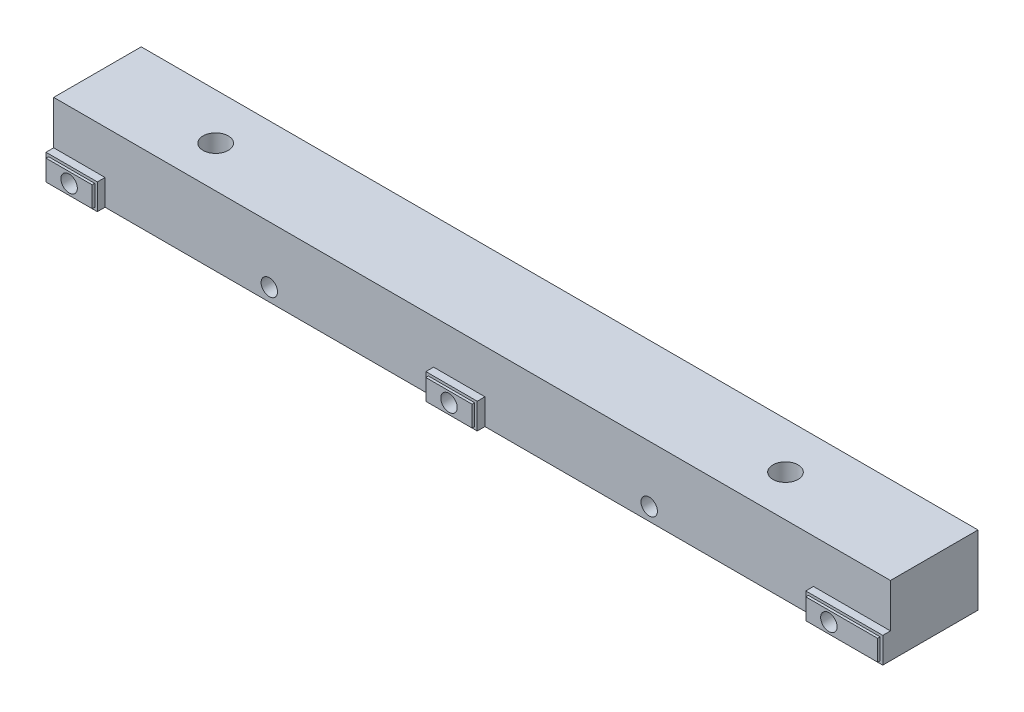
SolidWorks part; units mm, degrees
ref_plane "Front" through (0, 0, 0) normal (0, 0, 1) x (1, 0, 0)
ref_plane "Top" through (0, 0, 0) normal (0, 1, 0) x (1, 0, 0)
ref_plane "Right" through (0, 0, 0) normal (1, 0, 0) x (0, 0, -1)
sketch "Sketch1" plane through (0, 0, 0) normal (0, 1, 0) x (1, 0, 0)
  line L0 (0, 0) -> (0, 8.525) construction
  line L1 (-208, 8.525) -> (208, 8.525)
  line L2 (-208, 8.525) -> (-208, -8.525)
  line L3 (-208, -8.525) -> (208, -8.525)
  line L4 (208, 8.525) -> (208, -8.525)
  line L5 (0, 0) -> (208, 0) construction
  dimension "D1" = 416
  dimension "D2" = 17.05
extrude "Extrude1" add sketch "Sketch1" along normal blind 13.54
sketch "Sketch2" plane through (0, 13.54, 0) normal (0, 1, 0) x (1, 0, 0)
  circle A0 centre (0, -6.025) radius 2.413
  dimension "D1" = 4.826
  dimension "D2" = 6.025
extrude "Extrude2" cut sketch "Sketch2" against normal up to next
sketch "Sketch3" plane through (0, 0, 8.525) normal (0, 0, 1) x (1, 0, 0)
  line L1 (-166, 5.03) -> (-156, 5.03)
  line L2 (-166, 5.03) -> (-166, 0)
  line L3 (-166, 0) -> (-156, 0)
  line L4 (-156, 5.03) -> (-156, 0)
  line L6 (-208, 13.54) -> (-208, 0) construction
  line L7 (-208, 0) -> (208, 0) construction
  dimension "D1" = 42
  dimension "D2" = 10
  dimension "D3" = 5.03
extrude "Extrude3" add sketch "Sketch3" along normal blind 2
pattern_linear "LPattern1" count 4 spacing 37 along (1, 0, 0) of "Extrude3"
sketch "Sketch4" plane through (0, 0, 8.525) normal (0, 0, 1) x (1, 0, 0)
  line L1 (-208, 5.03) -> (-193, 5.03)
  line L2 (-208, 5.03) -> (-208, 0)
  line L3 (-208, 0) -> (-193, 0)
  line L4 (-193, 5.03) -> (-193, 0)
  line L5 (-208, 0) -> (-166, 0) construction
  line L6 (-156, 5.03) -> (-166, 5.03) construction
  line L7 (-208, 13.54) -> (-208, 0) construction
  dimension "D1" = 15
extrude "Extrude4" add sketch "Sketch4" along normal blind 2
sketch "Sketch8" plane through (0, 0, 0) normal (0, -1, 0) x (1, 0, 0)
  line L0 (208, 8.525) -> (208, -8.525) construction
  line L1 (-208, -8.525) -> (208, -8.525)
  line L2 (-208, -8.525) -> (-208, -2.525)
  line L3 (-208, -2.525) -> (208, -2.525)
  line L4 (208, -8.525) -> (208, -2.525)
  dimension "D1" = 6
extrude "Extrude8" [suppressed] add sketch "Sketch8" along normal blind 1
mirror "Mirror1" about plane through (0, 0, 0) normal (1, 0, 0) of "Extrude3", "LPattern1", "Extrude4"
hole_wizard "Ø3.2 (3.2) Diameter Hole1" positions "3DSketch1" profile "Sketch7" hole size "Ø3.2" standard "Ansi Metric"
sketch3d "3DSketch1"
  line L0 (208, 13.54, -8.525) -> (208, 0, -8.525) construction
  line L1 (208, 0, -8.525) -> (-208, 0, -8.525) construction
  point P0 (198, 2.515, -8.525)
  dimension "D1" = 10
  dimension "D2" = 2.515
sketch "Sketch7" plane through (198, 2.515, -8.525) normal (1, 0, 0) x (0, 1, 0)
  line L0 (0, 0) -> (0, 19.05)
  line L1 (0, 19.05) -> (1.6, 19.05)
  line L2 (1.6, 19.05) -> (1.6, 0.1)
  line L3 (1.6, 0.1) -> (1.7, 0)
  line L5 (1.7, 0) -> (0, 0)
  line L6 (-1.6, 0.1) -> (-1.7, 0) construction
  line L11 (0, -6.35) -> (0, 107.95) construction
  dimension "Thru Hole Dia." = 3.2
  dimension "Thru Hole Depth" = 19.05
  dimension "Near C'Sink Dia." = 3.4
  dimension "Near C'Sink Angle" = 90
pattern_linear "LPattern2" count 5 spacing 37 along (-1, 0, 0) of "Ø3.2 (3.2) Diameter Hole1"
mirror "Mirror2" about plane through (0, 0, 0) normal (1, 0, 0) of "Ø3.2 (3.2) Diameter Hole1", "LPattern2"
sketch "Sketch5" plane through (0, 0, 10.525) normal (0, 0, 1) x (1, 0, 0)
  line L8 (-207.5, 4.53) -> (-207.5, 0.5)
  line L9 (-207.5, 0.5) -> (-193.5, 0.5)
  line L10 (-193.5, 0.5) -> (-193.5, 4.53)
  line L11 (-193.5, 4.53) -> (-207.5, 4.53)
  line L12 (-207.5, 4.53) -> (-207.5, 0.5)
  line L13 (-207.5, 0.5) -> (-193.5, 0.5)
  line L14 (-193.5, 0.5) -> (-193.5, 4.53)
  line L15 (-193.5, 4.53) -> (-207.5, 4.53)
  line L20 (-165.5, 4.53) -> (-165.5, 0.5)
  line L21 (-165.5, 0.5) -> (-156.5, 0.5)
  line L22 (-156.5, 0.5) -> (-156.5, 4.53)
  line L23 (-156.5, 4.53) -> (-165.5, 4.53)
  line L24 (-165.5, 4.53) -> (-165.5, 0.5)
  line L25 (-165.5, 0.5) -> (-156.5, 0.5)
  line L26 (-156.5, 0.5) -> (-156.5, 4.53)
  line L27 (-156.5, 4.53) -> (-165.5, 4.53)
  line L32 (-128.5, 4.53) -> (-128.5, 0.5)
  line L33 (-128.5, 0.5) -> (-119.5, 0.5)
  line L34 (-119.5, 0.5) -> (-119.5, 4.53)
  line L35 (-119.5, 4.53) -> (-128.5, 4.53)
  line L36 (-128.5, 4.53) -> (-128.5, 0.5)
  line L37 (-128.5, 0.5) -> (-119.5, 0.5)
  line L38 (-119.5, 0.5) -> (-119.5, 4.53)
  line L39 (-119.5, 4.53) -> (-128.5, 4.53)
  line L44 (-91.5, 4.53) -> (-91.5, 0.5)
  line L45 (-91.5, 0.5) -> (-82.5, 0.5)
  line L46 (-82.5, 0.5) -> (-82.5, 4.53)
  line L47 (-82.5, 4.53) -> (-91.5, 4.53)
  line L48 (-91.5, 4.53) -> (-91.5, 0.5)
  line L49 (-91.5, 0.5) -> (-82.5, 0.5)
  line L50 (-82.5, 0.5) -> (-82.5, 4.53)
  line L51 (-82.5, 4.53) -> (-91.5, 4.53)
  line L56 (-54.5, 4.53) -> (-54.5, 0.5)
  line L57 (-54.5, 0.5) -> (-45.5, 0.5)
  line L58 (-45.5, 0.5) -> (-45.5, 4.53)
  line L59 (-45.5, 4.53) -> (-54.5, 4.53)
  line L60 (-54.5, 4.53) -> (-54.5, 0.5)
  line L61 (-54.5, 0.5) -> (-45.5, 0.5)
  line L62 (-45.5, 0.5) -> (-45.5, 4.53)
  line L63 (-45.5, 4.53) -> (-54.5, 4.53)
  line L68 (54.5, 0.5) -> (54.5, 4.53)
  line L69 (54.5, 4.53) -> (45.5, 4.53)
  line L70 (45.5, 4.53) -> (45.5, 0.5)
  line L71 (45.5, 0.5) -> (54.5, 0.5)
  line L72 (54.5, 0.5) -> (54.5, 4.53)
  line L73 (54.5, 4.53) -> (45.5, 4.53)
  line L74 (45.5, 4.53) -> (45.5, 0.5)
  line L75 (45.5, 0.5) -> (54.5, 0.5)
  line L80 (91.5, 0.5) -> (91.5, 4.53)
  line L81 (91.5, 4.53) -> (82.5, 4.53)
  line L82 (82.5, 4.53) -> (82.5, 0.5)
  line L83 (82.5, 0.5) -> (91.5, 0.5)
  line L84 (91.5, 0.5) -> (91.5, 4.53)
  line L85 (91.5, 4.53) -> (82.5, 4.53)
  line L86 (82.5, 4.53) -> (82.5, 0.5)
  line L87 (82.5, 0.5) -> (91.5, 0.5)
  line L92 (128.5, 0.5) -> (128.5, 4.53)
  line L93 (128.5, 4.53) -> (119.5, 4.53)
  line L94 (119.5, 4.53) -> (119.5, 0.5)
  line L95 (119.5, 0.5) -> (128.5, 0.5)
  line L96 (128.5, 0.5) -> (128.5, 4.53)
  line L97 (128.5, 4.53) -> (119.5, 4.53)
  line L98 (119.5, 4.53) -> (119.5, 0.5)
  line L99 (119.5, 0.5) -> (128.5, 0.5)
  line L104 (165.5, 0.5) -> (165.5, 4.53)
  line L105 (165.5, 4.53) -> (156.5, 4.53)
  line L106 (156.5, 4.53) -> (156.5, 0.5)
  line L107 (156.5, 0.5) -> (165.5, 0.5)
  line L108 (165.5, 0.5) -> (165.5, 4.53)
  line L109 (165.5, 4.53) -> (156.5, 4.53)
  line L110 (156.5, 4.53) -> (156.5, 0.5)
  line L111 (156.5, 0.5) -> (165.5, 0.5)
  line L116 (207.5, 0.5) -> (207.5, 4.53)
  line L117 (207.5, 4.53) -> (193.5, 4.53)
  line L118 (193.5, 4.53) -> (193.5, 0.5)
  line L119 (193.5, 0.5) -> (207.5, 0.5)
  line L120 (207.5, 0.5) -> (207.5, 4.53)
  line L121 (207.5, 4.53) -> (193.5, 4.53)
  line L122 (193.5, 4.53) -> (193.5, 0.5)
  line L123 (193.5, 0.5) -> (207.5, 0.5)
  line L124 (55, 0) -> (55, 5.03)
  line L125 (55, 5.03) -> (45, 5.03)
  line L126 (45, 5.03) -> (45, 0)
  line L127 (45, 0) -> (55, 0)
  line L128 (55, 0) -> (55, 5.03)
  line L129 (55, 5.03) -> (45, 5.03)
  line L130 (45, 5.03) -> (45, 0)
  line L131 (45, 0) -> (55, 0)
  line L132 (-55, 5.03) -> (-55, 0)
  line L133 (-55, 0) -> (-45, 0)
  line L134 (-45, 0) -> (-45, 5.03)
  line L135 (-45, 5.03) -> (-55, 5.03)
  line L136 (-55, 5.03) -> (-55, 0)
  line L137 (-55, 0) -> (-45, 0)
  line L138 (-45, 0) -> (-45, 5.03)
  line L139 (-45, 5.03) -> (-55, 5.03)
  line L140 (-92, 5.03) -> (-92, 0)
  line L141 (-92, 0) -> (-82, 0)
  line L142 (-82, 0) -> (-82, 5.03)
  line L143 (-82, 5.03) -> (-92, 5.03)
  line L144 (-92, 5.03) -> (-92, 0)
  line L145 (-92, 0) -> (-82, 0)
  line L146 (-82, 0) -> (-82, 5.03)
  line L147 (-82, 5.03) -> (-92, 5.03)
  line L148 (-129, 5.03) -> (-129, 0)
  line L149 (-129, 0) -> (-119, 0)
  line L150 (-119, 0) -> (-119, 5.03)
  line L151 (-119, 5.03) -> (-129, 5.03)
  line L152 (-129, 5.03) -> (-129, 0)
  line L153 (-129, 0) -> (-119, 0)
  line L154 (-119, 0) -> (-119, 5.03)
  line L155 (-119, 5.03) -> (-129, 5.03)
  line L156 (-166, 5.03) -> (-166, 0)
  line L157 (-166, 0) -> (-156, 0)
  line L158 (-156, 0) -> (-156, 5.03)
  line L159 (-156, 5.03) -> (-166, 5.03)
  line L160 (-166, 5.03) -> (-166, 0)
  line L161 (-166, 0) -> (-156, 0)
  line L162 (-156, 0) -> (-156, 5.03)
  line L163 (-156, 5.03) -> (-166, 5.03)
  line L164 (-208, 5.03) -> (-208, 0)
  line L165 (-208, 0) -> (-193, 0)
  line L166 (-193, 0) -> (-193, 5.03)
  line L167 (-193, 5.03) -> (-208, 5.03)
  line L168 (-208, 5.03) -> (-208, 0)
  line L169 (-208, 0) -> (-193, 0)
  line L170 (-193, 0) -> (-193, 5.03)
  line L171 (-193, 5.03) -> (-208, 5.03)
  line L172 (92, 0) -> (92, 5.03)
  line L173 (92, 5.03) -> (82, 5.03)
  line L174 (82, 5.03) -> (82, 0)
  line L175 (82, 0) -> (92, 0)
  line L176 (92, 0) -> (92, 5.03)
  line L177 (92, 5.03) -> (82, 5.03)
  line L178 (82, 5.03) -> (82, 0)
  line L179 (82, 0) -> (92, 0)
  line L180 (129, 0) -> (129, 5.03)
  line L181 (129, 5.03) -> (119, 5.03)
  line L182 (119, 5.03) -> (119, 0)
  line L183 (119, 0) -> (129, 0)
  line L184 (129, 0) -> (129, 5.03)
  line L185 (129, 5.03) -> (119, 5.03)
  line L186 (119, 5.03) -> (119, 0)
  line L187 (119, 0) -> (129, 0)
  line L188 (166, 0) -> (166, 5.03)
  line L189 (166, 5.03) -> (156, 5.03)
  line L190 (156, 5.03) -> (156, 0)
  line L191 (156, 0) -> (166, 0)
  line L192 (166, 0) -> (166, 5.03)
  line L193 (166, 5.03) -> (156, 5.03)
  line L194 (156, 5.03) -> (156, 0)
  line L195 (156, 0) -> (166, 0)
  line L196 (208, 0) -> (208, 5.03)
  line L197 (208, 5.03) -> (193, 5.03)
  line L198 (193, 5.03) -> (193, 0)
  line L199 (193, 0) -> (208, 0)
  line L200 (208, 0) -> (208, 5.03)
  line L201 (208, 5.03) -> (193, 5.03)
  line L202 (193, 5.03) -> (193, 0)
  line L203 (193, 0) -> (208, 0)
  dimension "D1" = 0.5
  dimension "D2" = 0.5
  dimension "D3" = 0.5
  dimension "D4" = 0.5
  dimension "D5" = 0.5
  dimension "D6" = 0.5
  dimension "D7" = 0.5
  dimension "D8" = 0.5
  dimension "D9" = 0.5
  dimension "D10" = 0.5
  dimension "D11" = 0
  dimension "D12" = 0
  dimension "D13" = 0
  dimension "D14" = 0
  dimension "D15" = 0
  dimension "D16" = 0
  dimension "D17" = 0
  dimension "D18" = 0
  dimension "D19" = 0
  dimension "D20" = 0
extrude "Extrude6" cut sketch "Sketch5" against normal blind 0.5
hole_wizard "CBORE for #10 Socket Head Cap Screw1" positions "3DSketch2" profile "Sketch12" counterbore size "#10" standard "Ansi Inch"
sketch3d "3DSketch2"
  circle A0 centre (0, 0, 6.025) radius 2.413 construction
  point P0 (0, 0, 6.025)
  point P5 (0, -2.413, 6.025)
sketch "Sketch12" plane through (0, 0, 6.025) normal (1, 0, 0) x (0, 0, -1)
  line L0 (0, 0) -> (0, 13.54)
  line L1 (0, 13.54) -> (2.4892, 13.54)
  line L3 (2.4892, 13.54) -> (2.4892, 4.826)
  line L4 (2.4892, 4.826) -> (4.7625, 4.826)
  line L5 (4.7625, 4.826) -> (4.7625, 0)
  line L7 (4.7625, 0) -> (0, 0)
  line L11 (0, -6.35) -> (0, 107.95) construction
  dimension "Thru Hole Dia." = 4.9784
  dimension "Thru Hole Depth" = 13.54
  dimension "C'Bore Dia." = 9.525
  dimension "C'Bore Depth" = 4.826
sketch "Sketch15" plane through (0, 0, 0) normal (0, -1, 0) x (1, 0, 0)
  line L41 (-208, -8.525) -> (208, -8.525)
  line L42 (-208, -8.525) -> (208, -8.525)
  line L59 (-4.0536, 8.525) -> (-45, 8.525)
  line L60 (-4.0536, 8.525) -> (-45, 8.525)
  line L75 (-45, 8.525) -> (-45, 10.025)
  line L76 (-45, 10.025) -> (-55, 10.025)
  line L77 (-55, 10.025) -> (-55, 8.525)
  line L78 (-55, 8.525) -> (-82, 8.525)
  line L81 (-82, 8.525) -> (-82, 10.025)
  line L82 (-82, 10.025) -> (-92, 10.025)
  line L83 (-92, 10.025) -> (-92, 8.525)
  line L84 (-92, 8.525) -> (-119, 8.525)
  line L87 (-119, 8.525) -> (-119, 10.025)
  line L88 (-119, 10.025) -> (-129, 10.025)
  line L89 (-129, 10.025) -> (-129, 8.525)
  line L90 (-129, 8.525) -> (-156, 8.525)
  line L93 (-156, 8.525) -> (-156, 10.025)
  line L94 (-156, 10.025) -> (-166, 10.025)
  line L95 (-166, 10.025) -> (-166, 8.525)
  line L96 (-166, 8.525) -> (-193, 8.525)
  line L99 (-193, 8.525) -> (-193, 10.025)
  line L100 (-193, 10.025) -> (-208, 10.025)
  line L101 (-208, 10.025) -> (-208, -8.525)
  line L103 (208, -8.525) -> (208, 10.025)
  line L104 (208, 10.025) -> (193, 10.025)
  line L105 (193, 10.025) -> (193, 8.525)
  line L106 (193, 8.525) -> (166, 8.525)
  line L109 (166, 8.525) -> (166, 10.025)
  line L110 (166, 10.025) -> (156, 10.025)
  line L111 (156, 10.025) -> (156, 8.525)
  line L112 (156, 8.525) -> (129, 8.525)
  line L115 (129, 8.525) -> (129, 10.025)
  line L116 (129, 10.025) -> (119, 10.025)
  line L117 (119, 10.025) -> (119, 8.525)
  line L118 (119, 8.525) -> (92, 8.525)
  line L121 (92, 8.525) -> (92, 10.025)
  line L122 (92, 10.025) -> (82, 10.025)
  line L123 (82, 10.025) -> (82, 8.525)
  line L124 (82, 8.525) -> (55, 8.525)
  line L127 (55, 8.525) -> (55, 10.025)
  line L128 (55, 10.025) -> (45, 10.025)
  line L129 (45, 10.025) -> (45, 8.525)
  line L130 (45, 8.525) -> (4.0536, 8.525)
  line L142 (-45, 8.525) -> (-45, 10.025)
  line L143 (-45, 10.025) -> (-55, 10.025)
  line L144 (-55, 10.025) -> (-55, 8.525)
  line L145 (-55, 8.525) -> (-82, 8.525)
  line L148 (-82, 8.525) -> (-82, 10.025)
  line L149 (-82, 10.025) -> (-92, 10.025)
  line L150 (-92, 10.025) -> (-92, 8.525)
  line L151 (-92, 8.525) -> (-119, 8.525)
  line L154 (-119, 8.525) -> (-119, 10.025)
  line L155 (-119, 10.025) -> (-129, 10.025)
  line L156 (-129, 10.025) -> (-129, 8.525)
  line L157 (-129, 8.525) -> (-156, 8.525)
  line L160 (-156, 8.525) -> (-156, 10.025)
  line L161 (-156, 10.025) -> (-166, 10.025)
  line L162 (-166, 10.025) -> (-166, 8.525)
  line L163 (-166, 8.525) -> (-193, 8.525)
  line L166 (-193, 8.525) -> (-193, 10.025)
  line L167 (-193, 10.025) -> (-208, 10.025)
  line L168 (-208, 10.025) -> (-208, -8.525)
  line L170 (208, -8.525) -> (208, 10.025)
  line L171 (208, 10.025) -> (193, 10.025)
  line L172 (193, 10.025) -> (193, 8.525)
  line L173 (193, 8.525) -> (166, 8.525)
  line L176 (166, 8.525) -> (166, 10.025)
  line L177 (166, 10.025) -> (156, 10.025)
  line L178 (156, 10.025) -> (156, 8.525)
  line L179 (156, 8.525) -> (129, 8.525)
  line L182 (129, 8.525) -> (129, 10.025)
  line L183 (129, 10.025) -> (119, 10.025)
  line L184 (119, 10.025) -> (119, 8.525)
  line L185 (119, 8.525) -> (92, 8.525)
  line L188 (92, 8.525) -> (92, 10.025)
  line L189 (92, 10.025) -> (82, 10.025)
  line L190 (82, 10.025) -> (82, 8.525)
  line L191 (82, 8.525) -> (55, 8.525)
  line L194 (55, 8.525) -> (55, 10.025)
  line L195 (55, 10.025) -> (45, 10.025)
  line L196 (45, 10.025) -> (45, 8.525)
  line L197 (45, 8.525) -> (4.0536, 8.525)
  arc A1 (-4.0536, 8.525) -> (4.0536, 8.525) centre (0, 6.025) ccw
  arc A2 (-4.0536, 8.525) -> (4.0536, 8.525) centre (0, 6.025) ccw
  dimension "D1" = 0
extrude "Extrude14" [suppressed] add sketch "Sketch15" along normal up to surface (1 mm away)
ref_plane "Plane1" through (-193.5, 4.53, 10.525) normal (0, 1, 0) x (-1, 0, 0)
sketch "Sketch19" plane through (0, 0, 0) normal (0, -1, 0) x (1, 0, 0)
  line L0 (45, 8.525) -> (45, -8.525)
  line L3 (208, -8.525) -> (-208, -8.525) construction
extrude "Extrude17" cut sketch "Sketch19" against normal through all and the other way through all flip side to cut
hole_wizard "#10 (0.1935) Diameter Hole1" positions "3DSketch3" profile "Sketch20" hole size "#10" standard "Ansi Inch"
sketch3d "3DSketch3"
  line L0 (68.5, 0, 8.525) -> (68.5, 0, 0.475) construction
  line L2 (179.5, 0, 8.525) -> (179.5, 0, 0.475) construction
  line L6 (68.5, 0, 0.475) -> (179.5, 0, 0.475) construction
  line L7 (208, 0, -8.525) -> (45, 0, -8.525) construction
  line L8 (55, 0, 8.525) -> (82, 0, 8.525) construction
  line L9 (166, 0, 8.525) -> (193, 0, 8.525) construction
  point P0 (68.5, 0, 0.475)
  point P2 (179.5, 0, 0.475)
  dimension "D1" = 9
sketch "Sketch20" plane through (68.5, 0, 0.475) normal (1, 0, 0) x (0, 0, -1)
  line L0 (0, 0) -> (0, 13.54)
  line L1 (0, 13.54) -> (2.4574, 13.54)
  line L2 (2.4574, 13.54) -> (2.4574, 0.3366)
  line L3 (2.4574, 0.3366) -> (2.794, 0)
  line L5 (2.794, 0) -> (0, 0)
  line L6 (-2.4574, 0.3366) -> (-2.794, 0) construction
  line L11 (0, -6.35) -> (0, 107.95) construction
  dimension "Thru Hole Dia." = 4.9149
  dimension "Thru Hole Depth" = 13.54
  dimension "Near C'Sink Dia." = 5.588
  dimension "Near C'Sink Angle" = 90
sketch "Sketch21" plane through (0, 0, 8.525) normal (0, 0, 1) x (1, 0, 0)
  line L1 (82, 5.03) -> (92, 5.03)
  line L2 (82, 5.03) -> (82, 0)
  line L3 (82, 0) -> (92, 0)
  line L4 (92, 5.03) -> (92, 0)
  line L5 (156, 5.03) -> (166, 5.03)
  line L6 (156, 5.03) -> (156, 0)
  line L7 (156, 0) -> (166, 0)
  line L8 (166, 5.03) -> (166, 0)
extrude "Extrude18" cut sketch "Sketch21" along normal through all
